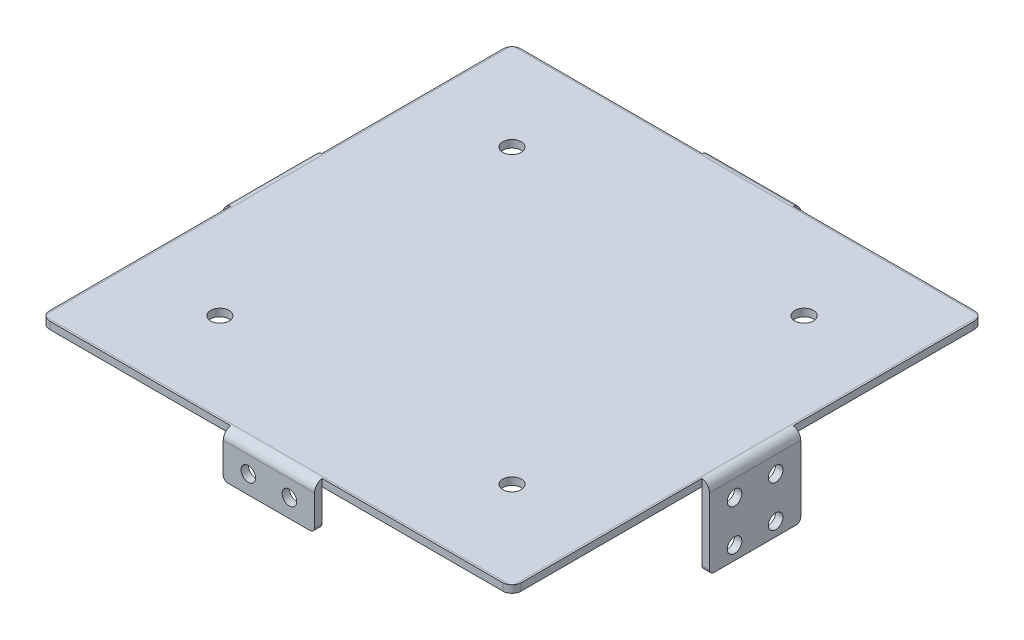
SolidWorks part; units mm, degrees
ref_plane "Front Plane" through (0, 0, 0) normal (0, 0, 1) x (1, 0, 0)
ref_plane "Top Plane" through (0, 0, 0) normal (0, 1, 0) x (1, 0, 0)
ref_plane "Right Plane" through (0, 0, 0) normal (1, 0, 0) x (0, 0, -1)
sketch "Sketch1" plane through (0, 0, 0) normal (0, 1, 0) x (1, 0, 0)
  line L1 (-51.63, -51.63) -> (51.63, -51.63)
  line L2 (-51.63, -51.63) -> (-51.63, 51.63)
  line L3 (-51.63, 51.63) -> (51.63, 51.63)
  line L4 (51.63, -51.63) -> (51.63, 51.63)
  line L5 (-51.63, -51.63) -> (51.63, 51.63) construction
  line L6 (-51.63, 51.63) -> (51.63, -51.63) construction
  point P0 (0, 0)
  dimension "D1" = 103.26
extrude "Boss-Extrude1" add sketch "Sketch1" along normal blind 1.63 contours L2 L1 L4 L3
sketch "Sketch2" plane through (0, 1.63, 0) normal (0, 1, 0) x (1, 0, 0)
  line L0 (-51.63, 51.63) -> (51.63, 51.63) construction
  line L1 (-10, 51.63) -> (10, 51.63)
  line L2 (-10, 51.63) -> (-10, 53.26)
  line L3 (-10, 53.26) -> (10, 53.26)
  line L4 (10, 51.63) -> (10, 53.26)
  line L5 (-51.63, -51.63) -> (-51.63, 51.63) construction
  line L6 (-51.63, 0) -> (51.63, 0) construction
  line L7 (51.63, -51.63) -> (51.63, 51.63) construction
  line L8 (-10, -53.26) -> (10, -53.26)
  line L9 (10, -51.63) -> (10, -53.26)
  line L10 (-10, -51.63) -> (10, -51.63)
  line L11 (-10, -51.63) -> (-10, -53.26)
  point P13 (0, 0)
  dimension "D1" = 20
  dimension "D2" = 41.63
  dimension "D3" = 1.63
sketch "Sketch3" plane through (0, 1.63, 0) normal (0, 1, 0) x (1, 0, 0)
  line L0 (0, 51.63) -> (0, -51.63) construction
  line L3 (51.63, -51.63) -> (51.63, 51.63) construction
  line L4 (51.63, -10) -> (53.26, -10)
  line L5 (51.63, -10) -> (51.63, 10)
  line L6 (51.63, 10) -> (53.26, 10)
  line L7 (53.26, -10) -> (53.26, 10)
  line L8 (-51.63, 51.63) -> (51.63, 51.63) construction
  line L9 (-51.63, -51.63) -> (51.63, -51.63) construction
  line L11 (-51.63, 10) -> (-53.26, 10)
  line L12 (-53.26, -10) -> (-53.26, 10)
  line L13 (-51.63, -10) -> (-53.26, -10)
  line L14 (-51.63, -10) -> (-51.63, 10)
  dimension "D1" = 20
  dimension "D2" = 41.63
  dimension "D3" = 1.63
extrude "Boss-Extrude2" add sketch "Sketch2" against normal blind 9.63
extrude "Boss-Extrude3" add sketch "Sketch3" against normal blind 17.58
sketch "Sketch4" plane through (0, 0, 53.26) normal (0, 0, 1) x (1, 0, 0)
  line L0 (0, 1.63) -> (0, -8) construction
  line L1 (-10, 1.63) -> (10, 1.63) construction
  line L2 (-10, -8) -> (10, -8) construction
  line L3 (-51.63, 0) -> (-10, 0) construction
  circle A0 centre (-4.5, -4) radius 1.6
  circle A1 centre (4.5, -4) radius 1.6
  dimension "D1" = 3.2
  dimension "D2" = 4.5
  dimension "D3" = 4
extrude "Cut-Extrude1" cut sketch "Sketch4" against normal through all
sketch "Sketch5" plane through (53.26, 0, 0) normal (1, 0, 0) x (0, 0, -1)
  line L1 (-10, -15.95) -> (-10, 1.63) construction
  line L2 (0, 1.63) -> (0, -15.95) construction
  line L3 (-10, 1.63) -> (10, 1.63) construction
  line L4 (-10, -15.95) -> (10, -15.95) construction
  line L5 (10, -8.5) -> (-10, -8.5) construction
  line L6 (10, -15.95) -> (10, 1.63) construction
  circle A0 centre (-4.5, -4) radius 1.6
  circle A1 centre (4.5, -4) radius 1.6
  circle A2 centre (4.5, -13) radius 1.6
  circle A3 centre (-4.5, -13) radius 1.6
  dimension "D1" = 3.2
  dimension "D2" = 4.5
  dimension "D3" = 4.5
  dimension "D4" = 7.45
extrude "Cut-Extrude2" cut sketch "Sketch5" against normal through all
fillet "Fillet1" radius 1 8 edges at (-10, -8, -52.445) (10, -8, -52.445) (10, -8, 52.445) (-10, -8, 52.445) (52.445, -15.95, 10) (52.445, -15.95, -10) (-52.445, -15.95, -10) (-52.445, -15.95, 10)
fillet "Fillet2" radius 2 4 edges at (53.26, 1.63, 0) (0, 1.63, -53.26) (0, 1.63, 53.26) (-53.26, 1.63, 0)
fillet "Fillet3" radius 2 4 edges at (51.63, 0.7977, -51.63) (51.63, 0.7977, 51.63) (-51.63, 0.7977, 51.63) (-51.63, 0.7977, -51.63)
sketch "Sketch6" plane through (0, 1.63, 0) normal (0, 1, 0) x (1, 0, 0)
  circle A9 centre (-32, 32) radius 2.025
  circle A10 centre (32, 32) radius 2.025
  circle A11 centre (32, -32) radius 2.025
  circle A12 centre (-32, -32) radius 2.025
  point P23 (0, 0)
  dimension "D1" = 32
  dimension "D5" = 2
  dimension "D3" = 4.05
  dimension "D2" = 32
  dimension "D4" = 2
extrude "Cut-Extrude4" cut sketch "Sketch6" against normal through all and the other way through all
